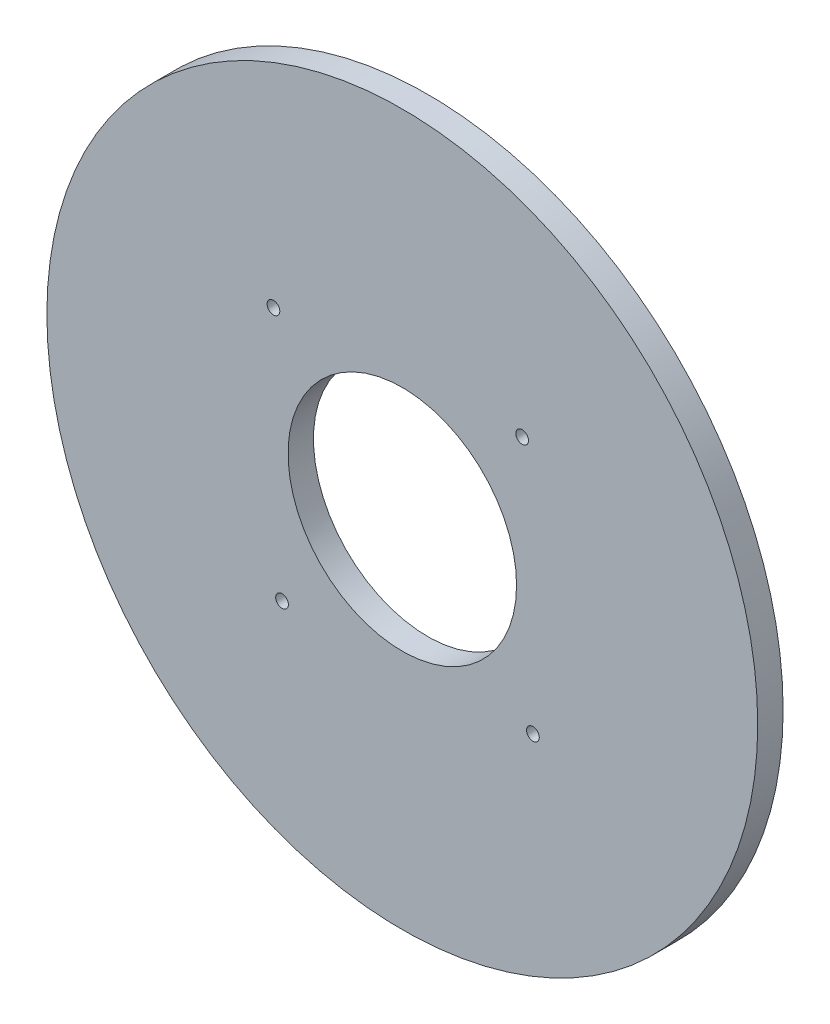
SolidWorks part; units mm, degrees
ref_plane "Front Plane" through (0, 0, 0) normal (0, 0, 1) x (1, 0, 0)
ref_plane "Top Plane" through (0, 0, 0) normal (0, 1, 0) x (1, 0, 0)
ref_plane "Right Plane" through (0, 0, 0) normal (1, 0, 0) x (0, 0, -1)
sketch "Sketch1" plane through (0, 0, 0) normal (0, 0, 1) x (1, 0, 0)
  circle A0 centre (0, 0) radius 88.9
  dimension "D1" = 177.8
extrude "Boss-Extrude1" add sketch "Sketch1" along normal blind 6.35
sketch "Sketch2" plane through (0, 0, 6.35) normal (0, 0, 1) x (1, 0, 0)
  circle A0 centre (0, 0) radius 28.575
  dimension "D1" = 57.15
extrude "Cut-Extrude1" cut sketch "Sketch2" against normal blind 6.35 contours A0
sketch "Sketch4" plane through (0, 0, 0) normal (0, 0, -1) x (-1, 0, 0)
  line L0 (0, 0) -> (64.4581, 59.4758) construction
  circle A1 centre (32.229, 29.7379) radius 1.5875
  dimension "D1" = 3.175
extrude "Cut-Extrude2" cut sketch "Sketch4" against normal blind 6.35 contours A1
sketch "Sketch5" plane through (0, 0, 0) normal (0, 0, -1) x (-1, 0, 0)
  line L0 (0, 0) -> (65.4428, 60.1702) construction
  line L1 (65.4428, 60.1702) -> (-65.4428, -60.1702) construction
  line L2 (-65.4428, -60.1702) -> (0, 0) construction
  line L3 (0, 0) -> (60.1702, -65.4428) construction
  line L4 (60.1702, -65.4428) -> (-60.1702, 65.4428) construction
  line L5 (-60.1702, 65.4428) -> (0, 0) construction
  circle A0 centre (0, 0) radius 88.9 construction
  circle A1 centre (30.0851, -32.7214) radius 1.5875
  dimension "D1" = 3.175
extrude "Cut-Extrude3" cut sketch "Sketch5" against normal blind 6.35 contours A1
sketch "Sketch6" plane through (0, 0, 0) normal (0, 0, -1) x (-1, 0, 0)
  line L0 (0, 0) -> (65.3269, 60.296) construction
  line L1 (65.3269, 60.296) -> (-65.3477, -60.2734) construction
  line L2 (-65.3477, -60.2734) -> (0, 0) construction
  line L3 (0, 0) -> (-32.6739, -30.1367) construction
  circle A0 centre (0, 0) radius 88.9 construction
  circle A1 centre (-32.6739, -30.1367) radius 1.5875
  dimension "D1" = 3.175
extrude "Cut-Extrude4" cut sketch "Sketch6" against normal blind 6.35 contours A1
sketch "Sketch7" plane through (0, 0, 0) normal (0, 0, -1) x (-1, 0, 0)
  line L0 (0, 0) -> (59.9538, -65.641) construction
  line L1 (59.9538, -65.641) -> (0, 0) construction
  line L2 (0, 0) -> (-59.9538, 65.641) construction
  line L3 (-59.9538, 65.641) -> (0, 0) construction
  line L4 (0, 0) -> (-29.9769, 32.8205) construction
  circle A0 centre (0, 0) radius 88.9 construction
  circle A1 centre (-29.9769, 32.8205) radius 1.5875
  dimension "D1" = 3.175
extrude "Cut-Extrude5" cut sketch "Sketch7" against normal blind 6.35 contours A1
